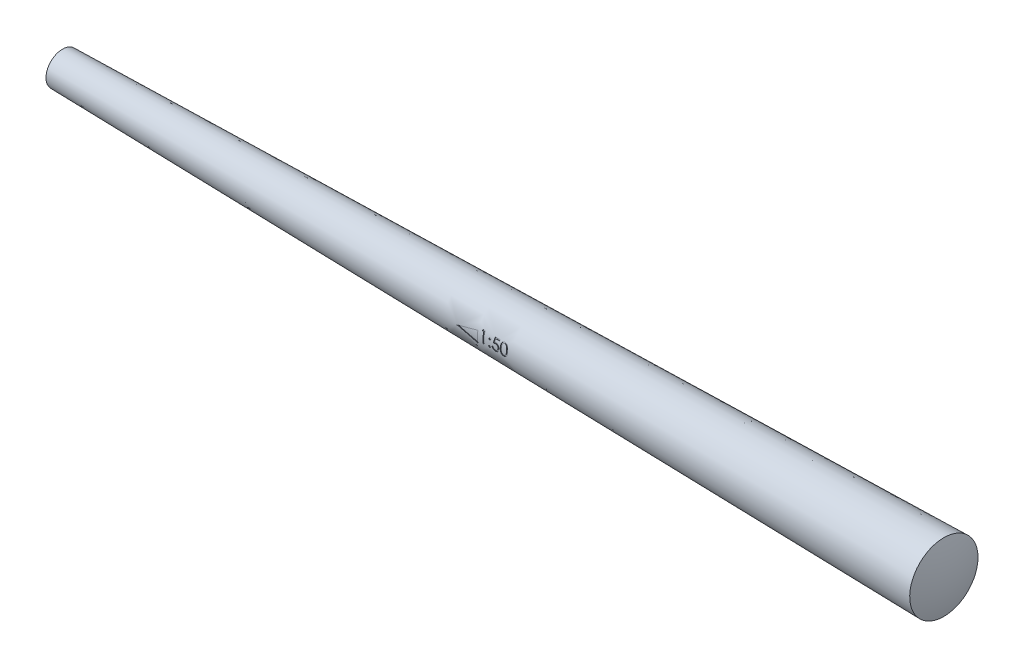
SolidWorks part; units mm, degrees
ref_plane "Front Plane" through (0, 0, 0) normal (0, 0, 1) x (1, 0, 0)
ref_plane "Top Plane" through (0, 0, 0) normal (0, 1, 0) x (1, 0, 0)
ref_plane "Right Plane" through (0, 0, 0) normal (1, 0, 0) x (0, 0, -1)
sketch "Sketch1" plane through (0, 0, 0) normal (1, 0, 0) x (0, 0, -1)
  circle A0 centre (0, 0) radius 1.5
  dimension "D1" = 3
extrude "Extrude1" add sketch "Sketch1" along normal mid plane 80
draft "Draft1" type of draft neutral plane draft angle 1.146 faces to draft 1 parameters "D1"=1.146
sketch "Sketch2" plane through (0, 0, 0) normal (0, 0, 1) x (1, 0, 0)
  line L0 (-40, 0) -> (-40, 1.5)
  line L1 (-40, 1.5) -> (-40, -1.5) construction
  line L2 (-40, 0) -> (-40.45, 0)
  line L3 (-40.45, 0) -> (-40.45, -2.3) construction
  line L4 (40, 0) -> (40, 3.1001)
  line L5 (40, -3.1001) -> (40, 3.1001) construction
  line L6 (40, 0) -> (40.45, 0)
  line L7 (40.45, 0) -> (40.45, -2.3) construction
  line L8 (-40, -1.5) -> (40, -3.1001) construction
  arc A0 (-40.45, 0) -> (-40, 1.5) centre (-37.725, 0) cw
  arc A1 (40.45, 0) -> (40, 3.1001) centre (29.5469, 0) ccw
  point P14 (0, -2.3)
revolve "Revolve1" add sketch "Sketch2" angle 360 about L2
sketch "Sketch5" plane through (0, 0, 0) normal (0, 0, 1) x (1, 0, 0)
  line L0 (0, 2.3) -> (0, -2.3) construction
  line L1 (40, 3.1001) -> (-40, 1.5) construction
  line L2 (-40, -1.5) -> (40, -3.1001) construction
ref_plane "Plane2" through (0, 0, 0) normal (-0.02, 0, 0.9998) x (0.9998, 0, 0.02)
sketch "Sketch6" plane through (0, 0, 0) normal (-0.02, 0, 0.9998) x (0.9998, 0, 0.02)
  line L0 (0, 0) -> (0, 0.5)
  line L1 (0, 2.3) -> (0, -2.3) construction
  line L2 (0, 0.5) -> (-1.866, 0)
  line L3 (-1.866, 0) -> (0, -0.5)
  line L4 (0, -0.5) -> (0, 0)
  line L5 (0, -0.25) -> (3, -0.25) construction
  text T0 "1:50" font "Century Gothic" height 1
  dimension "D1" = 1
  dimension "D2" = 30
  dimension "D3" = 3
wrap "Wrap2" sketch "Sketch6" wrap type deboss source sketch "Sketch6" thickness 0.05 parameters "D1"=0.05
equation "\"D2@Sketch2\" = \"D1@Sketch2\""
